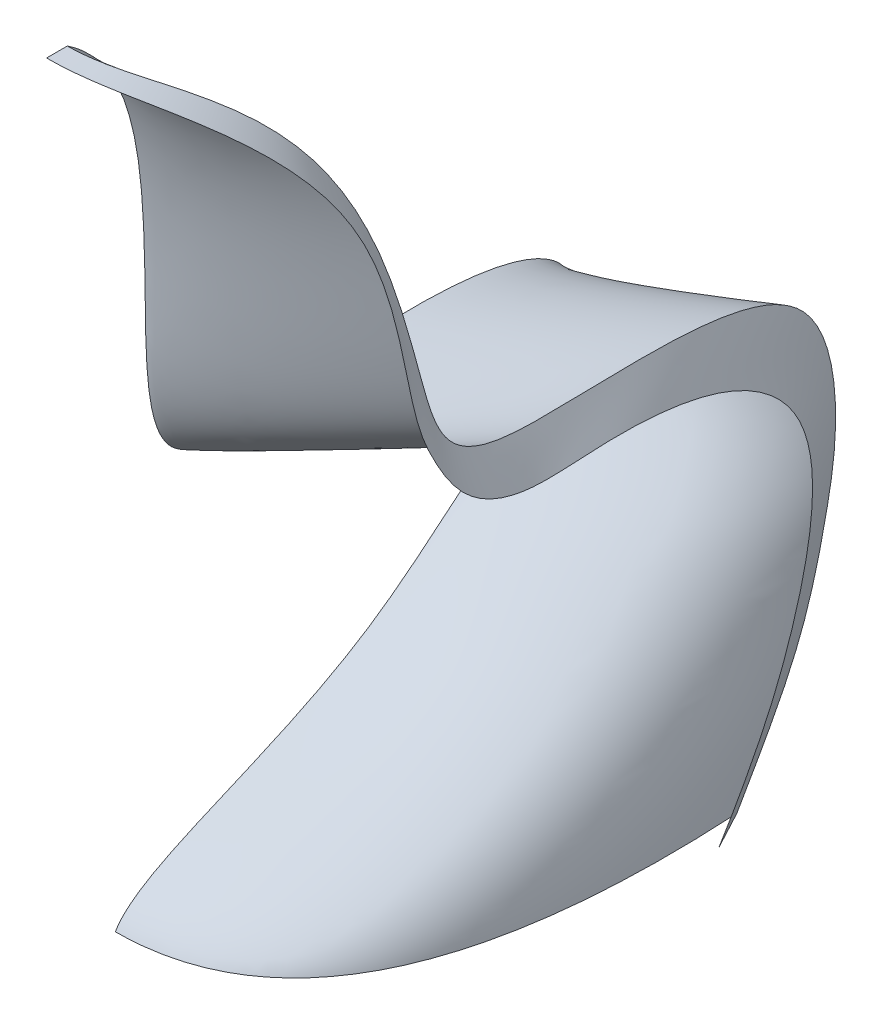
SolidWorks part; units mm, degrees
ref_plane "正面" through (0, 0, 0) normal (0, 0, 1) x (1, 0, 0)
ref_plane "平面" through (0, 0, 0) normal (0, 1, 0) x (1, 0, 0)
ref_plane "右側面" through (0, 0, 0) normal (1, 0, 0) x (0, 0, -1)
sketch "ｽｹｯﾁ1" plane through (0, 0, 0) normal (1, 0, 0) x (0, 0, -1)
  line L0 (178.6078, 870.7131) -> (1412.8679, 870.7131) construction
  line L1 (0, 0) -> (0, 570) construction
  line L2 (-107.4463, 0) -> (481.1986, 0)
  dimension "D1" = 570
sketch "ｽｹｯﾁ2" plane through (0, 0, 0) normal (1, 0, 0) x (0, 0, -1)
  line L0 (-107.4463, 0) -> (481.1986, 0) construction
  line L1 (181.2161, 69.7026) -> (299.1055, 160.8469) construction
  spline S0 degree 3 poles (0, 570) (42.9929, 541.7085) (54.3599, 477.327) (56.7113, 360.1838) (56.1207, 290.8076) (106.9716, 263.3364) (164.5923, 278.2893) (282.3306, 285.1208) (340.0697, 274.3475) (376.3187, 233.2018) (312.3565, 173.181) (167.4142, 56.1213) (53.434, 32.0852) (34.5704, 0) knots 0 0 0 0 0.151962 0.181615 0.283754 0.309269 0.411255 0.441279 0.579493 0.617249 0.781078 0.821401 1 1 1 1
ref_plane "平面1" through (150, 0, 0) normal (1, 0, 0) x (0, 0, -1)
sketch "ｽｹｯﾁ3" plane through (150, 0, 0) normal (1, 0, 0) x (0, 0, -1)
  line L0 (-107.4463, 0) -> (481.1986, 0) construction
  spline S0 degree 3 poles (0, 570) (48.1989, 552.8802) (86.7219, 502.2549) (99.4033, 430.1546) (112.3707, 360.7257) (120.165, 335.5704) (154.3431, 316.7886) (250.0017, 316.6236) (359.0254, 323.9039) (404.5959, 254.4941) (405.049, 198.0613) (385.0793, 91.8589) (370.3035, 65.4755) (332.4167, 0) knots 0 0 0 0 0.092713 0.174016 0.190388 0.249091 0.262589 0.318036 0.486713 0.518018 0.618522 0.655291 1 1 1 1
sketch "ｽｹｯﾁ6" plane through (0, 0, 0) normal (0, 0, 1) x (1, 0, 0)
  line L0 (0, 0) -> (150, 0) construction
  line L1 (150, 0) -> (150, 570) construction
  line L2 (150, 0) -> (150, 280)
  line L3 (0, 0) -> (0, 570) construction
  line L4 (-104.6563, 570) -> (104.6563, 570) construction
  spline S0 degree 3 poles (150, 280) (150, 290) (150, 490) (101.3333, 570) (0, 570) knots 0 0 0 0 0.05 1 1 1 1
  dimension "D2" = 600
  dimension "D3" = 320
  dimension "D1" = 280
curve "ｶｰﾌﾞ1"
sketch "ｽｹｯﾁ7" plane through (0, 0, 0) normal (0, 1, 0) x (1, 0, 0)
  line L4 (-133.3941, 34.5704) -> (133.3941, 34.5704) construction
  spline S0 degree 2 poles (150, 332.4167) (166.7426, 34.5704) (0, 34.5704) knots 0 0 0 1 1 1
sketch3d "3Dｽｹｯﾁ1"
  line L0 (-62.2947, 267.4853, -339.6594) -> (62.2947, 267.4853, -339.6594) construction
  line L1 (-63.6504, 344.0029, -57.1863) -> (63.6504, 344.0029, -57.1863) construction
  line L2 (-34.6333, 531.405, -34.1158) -> (34.6333, 531.405, -34.1158) construction
  spline S0 degree 2 poles (149.9961, 289.284, -380.0927) (25.4126, 267.4853, -339.6594) (0, 267.4853, -339.6594) knots 0 0 0 1 1 1
  spline S1 degree 3 number of poles 72 (0, 570, 0) -> (150, 280, -387.3827) construction
  spline S2 degree 3 poles (0, 570, 0) (0, 541.7085, -42.9929) (0, 477.327, -54.3599) (0, 360.1838, -56.7113) (0, 290.8076, -56.1207) (0, 263.3364, -106.9716) (0, 278.2893, -164.5923) (0, 285.1208, -282.3306) (0, 274.3475, -340.0697) (0, 233.2018, -376.3187) (0, 173.181, -312.3565) (0, 56.1213, -167.4142) (0, 32.0852, -53.434) (0, 0, -34.5704) knots 0 0 0 0 0.151962 0.181615 0.283754 0.309269 0.411255 0.441279 0.579493 0.617249 0.781078 0.821401 1 1 1 1 construction
  spline S3 degree 2 poles (146.5886, 377.676, -109.3774) (23.6326, 344.0029, -57.1863) (0, 344.0029, -57.1863) knots 0 0 0 1 1 1
  spline S4 degree 2 poles (83.5413, 543.338, -47.9008) (39.3474, 531.405, -34.1158) (0, 531.405, -34.1158) knots 0 0 0 1 1 1
surface "ｻｰﾌｪｽ-ﾛﾌﾄ1"
sketch "ｽｹｯﾁ8" plane through (0, 0, 0) normal (1, 0, 0) x (0, 0, -1)
  line L0 (0, 570) -> (-15, 570) construction
  line L1 (-107.4463, 0) -> (481.1986, 0) construction
  spline S0 degree 3 poles (-15, 570) (17.4696, 555.5967) (56.8107, 523.9339) (87.5465, 449.4033) (82.4091, 383.4711) (108.4735, 324.0946) (135.7656, 286.8863) (259.769, 297.4924) (325.2375, 284.9547) (379.0613, 222.6747) (373.8347, 156.1011) (338.7333, 57.3714) (314.6455, 16.539) (304.3558, 0) knots 0 0 0 0 0.139471 0.173767 0.324156 0.360193 0.498105 0.534495 0.687705 0.726159 0.880577 0.909891 1 1 1 1
  dimension "D1" = 15
sketch "ｽｹｯﾁ9" plane through (0, 0, 0) normal (0, 0, 1) x (1, 0, 0)
  line L0 (0, 0) -> (165, 0) construction
  line L1 (165, 0) -> (165, 280)
  line L2 (133.4616, 570) -> (-133.4616, 570) construction
  spline S0 degree 3 poles (0, 570) (110.8333, 570) (165, 490) (165, 290) (165, 280) knots 0 0 0 0 0.95 1 1 1 1
  dimension "D3" = 600
  dimension "D4" = 350
  dimension "D1" = 165
  dimension "D2" = 280
sketch "ｽｹｯﾁ11" plane through (150, 0, 0) normal (1, 0, 0) x (0, 0, -1)
  spline S0 degree 3 poles (1332.0745, -880.7906) (-704.973, 675.5814) (-11.6958, 690.0535) (87.5465, 449.4033) (82.4091, 383.4711) (108.4735, 324.0946) (135.7656, 286.8863) (259.769, 297.4924) (325.2375, 284.9547) (379.0613, 222.6747) (373.8347, 156.1011) (289.836, -80.162) (71.1749, -221.6295) (1575.1546, 1543.8724) knots -0.722504 -0.722504 -0.722504 -0.722504 0.139471 0.173767 0.324156 0.360193 0.498105 0.534495 0.687705 0.726159 0.880577 0.909891 1.381469 1.381469 1.381469 1.381469 only from (-15, 570) to (304.3558, 0) construction
  spline S1 degree 3 poles (-15, 570) (17.4696, 555.5967) (56.8107, 523.9339) (87.5465, 449.4033) (82.4091, 383.4711) (108.4735, 324.0946) (135.7656, 286.8863) (259.769, 297.4924) (325.2375, 284.9547) (379.0613, 222.6747) (373.8347, 156.1011) (338.7333, 57.3714) (314.6455, 16.539) (304.3558, 0) knots 0 0 0 0 0.139471 0.173767 0.324156 0.360193 0.498105 0.534495 0.687705 0.726159 0.880577 0.909891 1 1 1 1
curve "ｶｰﾌﾞ3"
sketch "ｽｹｯﾁ12" plane through (0, 0, 0) normal (1, 0, 0) x (0, 0, -1)
  line L0 (-15, 570) -> (0, 570)
sketch3d "3Dｽｹｯﾁ3"
  spline S0 degree 1 poles (164.9731, 297.4894, -145.3648) (149.7286, 318.7068, -161.7207) knots 0 0 1 1
  spline S1 degree 3 poles (0, 570, 15) (6.1321, 570, 15) (12.194, 569.7679, 14.4694) (21.1733, 569.0205, 12.8278) (24.1558, 568.7029, 12.1374) (29.9738, 567.9411, 10.5173) (32.8228, 567.4962, 9.5861) (41.206, 565.9685, 6.472) (46.5775, 564.6938, 3.97) (56.9623, 561.6086, -1.6784) (61.8815, 559.8251, -4.7727) (71.2322, 555.806, -11.2597) (75.6767, 553.5661, -14.6614) (84.1936, 548.6057, -21.6463) (88.2781, 545.8755, -25.2422) (99.9757, 536.9672, -36.0588) (106.9449, 530.1699, -43.216) (116.5231, 518.4429, -53.2536) (119.5852, 514.2464, -56.5013) (125.3403, 505.4293, -62.5066) (128.0385, 500.8086, -65.2675) (133.123, 491.103, -70.1749) (135.5078, 486.0191, -72.3252) (139.9768, 475.385, -75.9954) (142.0677, 469.8048, -77.5077) (147.732, 452.9401, -81.1829) (150.7746, 441.3858, -82.5837) (155.783, 417.9455, -84.7967) (157.7481, 406.0471, -85.569) (160.0846, 388.1746, -87.4767) (160.758, 382.2345, -88.2388) (161.9226, 370.47, -90.3726) (162.4133, 364.6485, -91.7578) (163.0322, 356.0957, -94.7074) (163.2198, 353.2617, -95.8287) (163.5578, 347.6959, -98.2586) (163.7083, 344.9643, -99.5643) (164.1149, 336.8542, -103.6326) (164.3247, 331.5689, -106.5611) (164.6427, 321.5129, -113.3231) (164.7511, 316.7049, -117.2109) (164.8566, 310.4143, -123.7575) (164.8826, 308.4586, -126.0628) (164.9228, 304.8511, -130.9386) (164.9371, 303.1888, -133.5297) (164.9693, 298.7665, -141.5591) (164.9775, 296.5788, -147.2041) (164.9856, 294.2206, -156.0261) (164.9874, 293.5881, -159.0372) (164.9899, 292.6152, -165.0404) (164.9907, 292.2697, -168.0465) (164.9922, 291.5833, -177.0765) (164.9921, 291.6194, -183.1126) (164.9912, 292.0237, -195.1957) (164.9904, 292.3923, -201.2425) (164.9888, 293.0486, -213.3342) (164.9881, 293.3149, -219.3797) (164.9875, 293.5357, -231.4689) (164.9876, 293.5096, -237.5126) (164.9891, 292.93, -255.6411) (164.9922, 291.878, -267.7834) (164.9982, 287.7576, -291.5295) (165, 284.7182, -303.1748) (165, 280, -314.4295) knots 0 0 0 0 0.03125 0.03125 0.046875 0.046875 0.0625 0.0625 0.09375 0.09375 0.125 0.125 0.15625 0.15625 0.1875 0.1875 0.25 0.25 0.28125 0.28125 0.3125 0.3125 0.34375 0.34375 0.375 0.375 0.4375 0.4375 0.5 0.5 0.53125 0.53125 0.5625 0.5625 0.578125 0.578125 0.59375 0.59375 0.625 0.625 0.65625 0.65625 0.671875 0.671875 0.6875 0.6875 0.71875 0.71875 0.734375 0.734375 0.75 0.75 0.78125 0.78125 0.8125 0.8125 0.84375 0.84375 0.875 0.875 0.9375 0.9375 1 1 1 1 construction
  spline S2 degree 3 number of poles 72 (0, 570, 0) -> (150, 280, -387.3827) construction
surface "ｻｰﾌｪｽ-ﾛﾌﾄ2"
surface "ｻｰﾌｪｽ-編みあわせ1"
